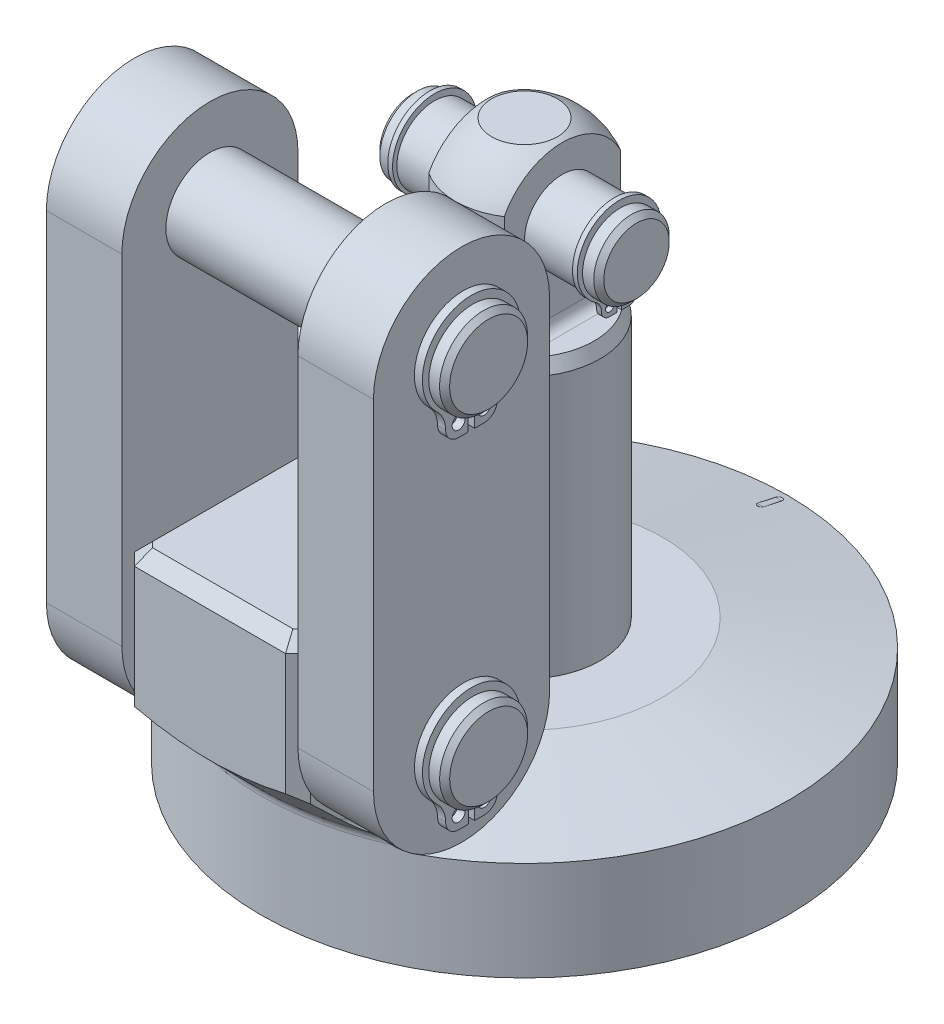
SolidWorks part; units mm, degrees
ref_plane "Front Plane" through (0, 0, 0) normal (0, 0, 1) x (1, 0, 0)
ref_plane "Top Plane" through (0, 0, 0) normal (0, 1, 0) x (1, 0, 0)
ref_plane "Right Plane" through (0, 0, 0) normal (1, 0, 0) x (0, 0, -1)
sketch "Sketch1" plane through (0, 0, 0) normal (0, 1, 0) x (1, 0, 0)
  line L0 (-6.9977, 0) -> (6.9977, 0)
  line L1 (6.9977, 0) -> (6.9977, -24.9936)
  line L2 (6.9977, -24.9936) -> (-6.9977, -24.9936)
  line L3 (-6.9977, -24.9936) -> (-6.9977, 0)
  line L4 (0, 1.05) -> (0, -22.05) construction
  dimension "D1" = 13.9954
  dimension "D2" = 24.9936
extrude "Extrude1" add sketch "Sketch1" along normal blind 24
sketch "S2D0003" plane through (0, 0, 0) normal (1, 0, 0) x (0, 0, -1)
  line L0 (0, 0) -> (0, 10)
  line L1 (-24.9936, 0) -> (0, 0)
  line L2 (-24.9936, 0) -> (-24.9936, 7.0256)
  line L3 (0, 10) -> (-11, 10)
  line L4 (-11, 10) -> (-24.9936, 7.0256)
  line L5 (0, 9.45) -> (0, -2.5987) construction
  line L6 (0, 24) -> (0, 0) construction
  line L8 (-24.9936, 0) -> (0, 0) construction
  line L10 (-24.9936, 24) -> (-24.9936, 0) construction
  dimension "D1" = 10
  dimension "D2" = 12
  dimension "D3" = 22
sketch "S2D0004" plane through (0, 0, 0) normal (1, 0, 0) x (0, 0, -1)
  line L0 (-35.0012, 22.6477) -> (-21.2606, 8.9071)
  line L1 (-20.9677, 8.2) -> (-20.9677, 0)
  line L2 (0, 16.6313) -> (0, -1.1122) construction
  line L3 (0, 24) -> (0, 0) construction
  line L5 (-24.9936, 0) -> (0, 0) construction
  line L6 (-35.0012, 22.6477) -> (-35.0012, 0)
  line L7 (-35.0012, 0) -> (-20.9677, 0)
  line L8 (-24.9936, 24) -> (-24.9936, 0) construction
  arc A0 (-20.9677, 8.2) -> (-21.2606, 8.9071) centre (-21.9677, 8.2) ccw
  dimension "D4" = 1
  dimension "D1" = 41.9354
  dimension "D2" = 8.2
  dimension "D3" = 45
  dimension "D5" = 10.0076
sketch "Sketch4" plane through (0, 0, 0) normal (1, 0, 0) x (0, 0, -1)
  line L0 (0, 10) -> (11, 10)
  line L1 (11, 10) -> (11, 24)
  line L2 (11, 24) -> (0, 24)
  line L3 (0, 24) -> (0, 10)
  line L4 (0, 21.6) -> (0, 8.4) construction
  line L5 (0, 24) -> (0, 0) construction
  line L6 (-24.9936, 24) -> (0, 24) construction
  dimension "D1" = 22
  dimension "D2" = 14
revolve "Cut-Revolve5" cut sketch "Sketch4" angle 360 about L4
revolve "Revolve1" add sketch "S2D0003" angle 360 about L5
revolve "Cut-Revolve4" cut sketch "S2D0004" angle 360 about L2
sketch "Sketch7" plane through (6.9977, 0, 0) normal (1, 0, 0) x (0, 0, -1)
  line L0 (-20.9677, 0) -> (20.9677, 0) construction
  circle A0 centre (-18, 17) radius 3.5
  dimension "D1" = 7
  dimension "D2" = 17
  dimension "D3" = 18
extrude "Cut-Extrude3" cut sketch "Sketch7" against normal through all
fillet "Fillet1" radius 1.5 2 edges at (-6.9977, 17, 8.4872) (6.9977, 17, 8.4872)
fillet "Fillet2" radius 3.18 5 edges at (-6.2681, 9.8405, 9.9391) (0, 10, 11) (6.2604, 9.8422, 9.9345)
chamfer "Chamfer1" distance 1 angle 45 2 edges at (-6.9977, 18.8006, 24.9936) (6.9977, 18.8006, 24.9936)
chamfer "Chamfer2" distance 1 angle 45 8 edges at (-6.9977, 24, 17.6098) (-6.2916, 24, 9.9534) (0, 24, 11) (6.2916, 24, 9.9534) (-6.4977, 24, 24.4936) (6.9977, 24, 17.6098) (6.4977, 24, 24.4936) (0, 24, 24.9936)
ref_plane "Plane1" through (0, 0, 18) normal (0, 0, 1) x (1, 0, 0)
sketch "Sketch8" plane through (0, 0, 18) normal (0, 0, 1) x (1, 0, 0)
  line L0 (6.9977, 17) -> (6.9977, 9.5)
  line L1 (7.7577, 8.74) -> (15.2577, 8.74)
  line L2 (15.2577, 8.74) -> (15.2577, 17)
  line L3 (15.2577, 17) -> (6.9977, 17)
  line L4 (5.637, 17) -> (19.4125, 17) construction
  line L5 (-6.9977, 17) -> (6.9977, 17) construction
  line L6 (6.9977, 24) -> (6.9977, 13.6012) construction
  line L7 (0, 0) -> (0, 26.6501) construction
  line L8 (-15.2577, 17) -> (-6.9977, 17)
  line L9 (-15.2577, 8.74) -> (-15.2577, 17)
  line L10 (-7.7577, 8.74) -> (-15.2577, 8.74)
  line L11 (-6.9977, 17) -> (-6.9977, 9.5)
  arc A0 (6.9977, 9.5) -> (7.7577, 8.74) centre (7.7577, 9.5) ccw
  arc A1 (-6.9977, 9.5) -> (-7.7577, 8.74) centre (-7.7577, 9.5) cw
  dimension "D4" = 0.76
  dimension "D2" = 16.52
  dimension "D3" = 8.26
revolve "Cut-Revolve6" cut sketch "Sketch8" angle 360 about L4
sketch "Sketch10" plane through (0, 0, 0) normal (1, 0, 0) x (0, 0, -1)
  line L0 (0, 10) -> (0, 44.3814)
  line L1 (0, 44.3814) -> (2.6153, 44.3814)
  line L2 (5.5, 41.3793) -> (5.5, 31.8537)
  line L3 (5.5, 31.8537) -> (6, 30.7814)
  line L4 (6, 30.7814) -> (6, 10)
  line L5 (6, 10) -> (0, 10)
  line L6 (0, 44.745) -> (0, 7.55) construction
  line L7 (22.759, -22.512) -> (-24.5324, -22.512) construction
  line L9 (11, 10) -> (-7.3495, 10) construction
  arc A0 (5.5, 41.3793) -> (2.6153, 44.3814) centre (0, 38.9814) ccw
  circle A1 centre (0, 38.9814) radius 3 construction
  dimension "D2" = 6
  dimension "D3" = 6
  dimension "D5" = 61.4934
  dimension "D1" = 5.4
  dimension "D4" = 32.512
  dimension "D6" = 12
  dimension "D7" = 11
  dimension "D8" = 25
  dimension "D9" = 13.6
  dimension "D10" = 34.3814
  dimension "D11" = 20.7814
revolve "Revolve2" add sketch "Sketch10" angle 360 about L6
sketch "Sketch12" plane through (0, 0, 0) normal (0, 0, 1) x (1, 0, 0)
  line L0 (3, 44.3814) -> (6, 44.3814)
  line L1 (6, 44.3814) -> (6, 31.7814)
  line L2 (6, 31.7814) -> (3.8128, 31.7814)
  line L3 (3, 32.5942) -> (3, 44.3814)
  line L4 (2.6153, 44.3814) -> (-2.6153, 44.3814) construction
  line L5 (6, 10) -> (6, 30.7814) construction
  line L6 (-3, 32.5942) -> (-3, 44.3814)
  line L7 (-6, 31.7814) -> (-3.8128, 31.7814)
  line L8 (0, 38.525) -> (0, 26.975) construction
  line L9 (-6, 44.3814) -> (-6, 31.7814)
  line L10 (-3, 44.3814) -> (-6, 44.3814)
  arc A0 (3, 32.5942) -> (3.8128, 31.7814) centre (3.8128, 32.5942) ccw
  arc A1 (-3, 32.5942) -> (-3.8128, 31.7814) centre (-3.8128, 32.5942) cw
  dimension "D3" = 0.8128
  dimension "D1" = 6
  dimension "D2" = 12.6
extrude "Cut-Extrude5" cut sketch "Sketch12" against normal mid plane 12
sketch "Sketch14" plane through (3, 0, 0) normal (1, 0, 0) x (0, 0, -1)
  line L0 (2.6153, 44.3814) -> (-2.6153, 44.3814) construction
  circle A0 centre (0, 38.9814) radius 3
  dimension "D2" = 6
  dimension "D1" = 5.4
extrude "Cut-Extrude7" cut sketch "Sketch14" against normal up to next
sketch "S2D0005" plane through (6.9977, 0, 0) normal (1, 0, 0) x (0, 0, -1)
  line L0 (-25.0045, 43.9988) -> (-25, 16.9988)
  line L1 (-11.0045, 44.0012) -> (-11, 17.0012)
  line L2 (-18.0045, 44) -> (-18, 17) construction
  line L3 (0, 38.9814) -> (0.0041, 43.9852) construction
  line L4 (0.0041, 43.9852) -> (-18.0045, 44) construction
  arc A0 (-11.0045, 44.0012) -> (-25.0045, 43.9988) centre (-18.0045, 44) ccw
  arc A1 (-25, 16.9988) -> (-11, 17.0012) centre (-18, 17) ccw
  circle A2 centre (-18.0045, 44) radius 3.5
  circle A3 centre (-18, 17) radius 3.5
  circle A6 centre (-18, 17) radius 3.5 construction
  dimension "D2" = 27
  dimension "D1" = 14
  dimension "D3" = 18.0086
  dimension "D4" = 5.0038
extrude "Extrude2" add sketch "S2D0005" along normal blind 6
sketch "S2D0006" plane through (0, 0, 0) normal (0, 0, 1) x (1, 0, 0)
  line L0 (-7.15, 41.9814) -> (7.15, 41.9814)
  line L1 (8.9, 41.5814) -> (8.9, 38.9814)
  line L2 (8.5, 41.9814) -> (8.9, 41.5814)
  line L3 (7.61, 41.9814) -> (8.5, 41.9814)
  line L4 (7.61, 41.8014) -> (7.61, 41.9814)
  line L5 (7.15, 41.8014) -> (7.61, 41.8014)
  line L6 (7.15, 41.9814) -> (7.15, 41.8014)
  line L7 (8.9, 38.9814) -> (-8.9, 38.9814)
  line L8 (-7.15, 41.9814) -> (-7.15, 41.8014)
  line L9 (-7.15, 41.8014) -> (-7.61, 41.8014)
  line L10 (-7.61, 41.8014) -> (-7.61, 41.9814)
  line L11 (-7.61, 41.9814) -> (-8.5, 41.9814)
  line L12 (-8.5, 41.9814) -> (-8.9, 41.5814)
  line L13 (-8.9, 41.5814) -> (-8.9, 38.9814)
  line L14 (-8.274, 38.9814) -> (8.415, 38.9814) construction
  line L15 (-3, 38.9814) -> (3, 38.9814) construction
  line L16 (0, 40.8686) -> (0, 24.9357) construction
  line L17 (0, 31.8537) -> (0, 41.3793) construction
  line L18 (3, 41.9814) -> (-3, 41.9814) construction
  dimension "D1" = 17.8
  dimension "D2" = 6
  dimension "D3" = 0.46
  dimension "D4" = 5.64
  dimension "D5" = 14.3
  dimension "D6" = 0.4
  dimension "D7" = 45
revolve "Revolve3" add sketch "S2D0006" angle 360 about L14
ref_plane "Plane2" through (0, 0, 18) normal (0, 0, 1) x (1, 0, 0)
sketch "Sketch18" plane through (0, 0, 18) normal (0, 0, 1) x (1, 0, 0)
  line L0 (-13.15, 20.5) -> (13.15, 20.5)
  line L1 (15.15, 20.1) -> (15.15, 17)
  line L2 (14.75, 20.5) -> (15.15, 20.1)
  line L3 (13.89, 20.5) -> (14.75, 20.5)
  line L4 (13.89, 20.24) -> (13.89, 20.5)
  line L5 (13.15, 20.24) -> (13.89, 20.24)
  line L6 (13.15, 20.5) -> (13.15, 20.24)
  line L7 (-13.15, 20.5) -> (-13.15, 20.24)
  line L8 (-13.15, 20.24) -> (-13.89, 20.24)
  line L9 (-13.89, 20.24) -> (-13.89, 20.5)
  line L10 (-13.89, 20.5) -> (-14.75, 20.5)
  line L11 (-14.75, 20.5) -> (-15.15, 20.1)
  line L12 (-15.15, 20.1) -> (-15.15, 17)
  line L13 (-13.915, 17) -> (14.4189, 17) construction
  line L14 (-6.9977, 17) -> (12.9977, 17) construction
  line L15 (0, 28.7058) -> (0, -18.8155) construction
  line L16 (-15.15, 17) -> (15.15, 17)
  line L17 (12.9977, 20.5) -> (-6.9977, 20.5) construction
  dimension "D1" = 7
  dimension "D2" = 30.3
  dimension "D3" = 6.48
  dimension "D4" = 0.74
  dimension "D5" = 26.3
  dimension "D6" = 0.4
  dimension "D7" = 45
revolve "Revolve4" add sketch "Sketch18" angle 360 about L13
sketch "Sketch20" plane through (7.15, 0, 0) normal (1, 0, 0) x (0, 0, -1)
  line L0 (0.1775, 34.8367) -> (0.76, 34.8367)
  line L1 (0.1775, 36.2567) -> (0.1775, 34.8367)
  line L2 (-0.1775, 36.2567) -> (-0.1775, 34.8367)
  line L3 (-0.1775, 34.8367) -> (-0.76, 34.8367)
  line L4 (0, 30.527) -> (0, 23.2449) construction
  arc A0 (0.1775, 36.2567) -> (-0.1775, 36.2567) centre (0, 38.9814) ccw
  arc A1 (1.8856, 36.3745) -> (-1.8856, 36.3745) centre (0, 39.1299) ccw
  circle A2 centre (0, 38.9814) radius 3 construction
  circle A3 centre (0.76, 35.4967) radius 0.33
  arc A4 (1.42, 35.4947) -> (0.76, 34.8367) centre (0.76, 35.4967) cw
  arc A5 (-1.42, 35.4947) -> (-1.8856, 36.3745) centre (-2.4898, 35.4916) ccw
  arc A6 (-1.42, 35.4947) -> (-0.76, 34.8367) centre (-0.76, 35.4967) ccw
  circle A7 centre (-0.76, 35.4967) radius 0.33
  arc A8 (1.42, 35.4947) -> (1.8856, 36.3745) centre (2.4898, 35.4916) cw
  point P18 (-1.6368, -1.5779)
  dimension "D1" = 0.355
  dimension "D2" = 2.7305
  dimension "D3" = 3.3389
  dimension "D4" = 0.1485
  dimension "D6" = 0.66
  dimension "D9" = 0.66
  dimension "D10" = 1.0698
  dimension "D7" = 1.52
  dimension "D8" = 3.4847
extrude "Extrude4" add sketch "Sketch20" along normal blind 0.381
sketch "Sketch21" plane through (13.15, 0, 0) normal (1, 0, 0) x (0, 0, -1)
  line L0 (-17.742, 11.7786) -> (-16.9831, 11.7788)
  line L1 (-17.7423, 13.8355) -> (-17.742, 11.7786)
  line L2 (-18.2566, 13.8354) -> (-18.2563, 11.7786)
  line L3 (-18.2563, 11.7786) -> (-19.0151, 11.7784)
  line L4 (-17.9983, 6.5985) -> (-17.9972, 0.0369) construction
  line L5 (-25.0045, 43.9988) -> (-25, 16.9988) construction
  arc A0 (-17.7423, 13.8355) -> (-18.2566, 13.8354) centre (-18, 17) ccw
  arc A1 (-15.2891, 14.3605) -> (-20.7101, 14.3596) centre (-18, 17.1641) ccw
  circle A2 centre (-16.9833, 12.8198) radius 0.5205
  arc A3 (-15.9423, 12.8199) -> (-16.9831, 11.7788) centre (-16.9833, 12.8198) cw
  arc A4 (-15.9423, 12.8199) -> (-15.2891, 14.3605) centre (-13.7996, 12.8201) cw
  arc A5 (-20.0563, 12.8192) -> (-20.7101, 14.3596) centre (-22.1991, 12.8187) ccw
  arc A6 (-20.0563, 12.8192) -> (-19.0151, 11.7784) centre (-19.0153, 12.8194) ccw
  circle A7 centre (-19.0153, 12.8194) radius 0.5205
  circle A8 centre (-18, 17) radius 3.5 construction
  dimension "D1" = 3.175
  dimension "D2" = 3.8999
  dimension "D3" = 0.1641
  dimension "D7" = 1.041
  dimension "D8" = 1.041
  dimension "D9" = 4.1806
  dimension "D10" = 2.1427
  dimension "D4" = 0.5142
  dimension "D6" = 2.032
extrude "Extrude5" add sketch "Sketch21" along normal blind 0.635
pattern_linear "LPattern1" count 2 spacing 27 along (0, 1, 0.0002) of "Extrude5", "Revolve4"
mirror "Mirror1" about plane through (0, 0, 0) normal (1, 0, 0) of "Extrude5", "LPattern1", "Extrude4", "Extrude2"
sketch "Sketch22" plane through (0, 0, 0) normal (1, 0, 0) x (0, 0, -1)
  line L0 (11.9304, 10.5792) -> (22.6749, 8.2954) construction
  line L1 (20.9677, 7.8813) -> (11, 10) construction
  line L2 (18.5223, 8.4011) -> (20.4786, 7.9853) construction
  line L3 (18.9247, 9.0925) -> (20.3923, 8.7806) construction
  line L5 (18.7584, 8.31) -> (20.226, 7.9981)
  line L7 (18.1422, 9.2589) -> (21.1748, 8.6143)
  arc A0 (18.1422, 9.2589) -> (18.7584, 8.31) centre (18.9247, 9.0925) ccw
  arc A1 (20.226, 7.9981) -> (21.1748, 8.6143) centre (20.3923, 8.7806) ccw
  dimension "D2" = 0.8
  dimension "D1" = 2
  dimension "D3" = 0.76
  dimension "D4" = 2.5
  dimension "D5" = 0.04
revolve "Cut-Revolve7" cut sketch "Sketch22" angle 360 about L0
